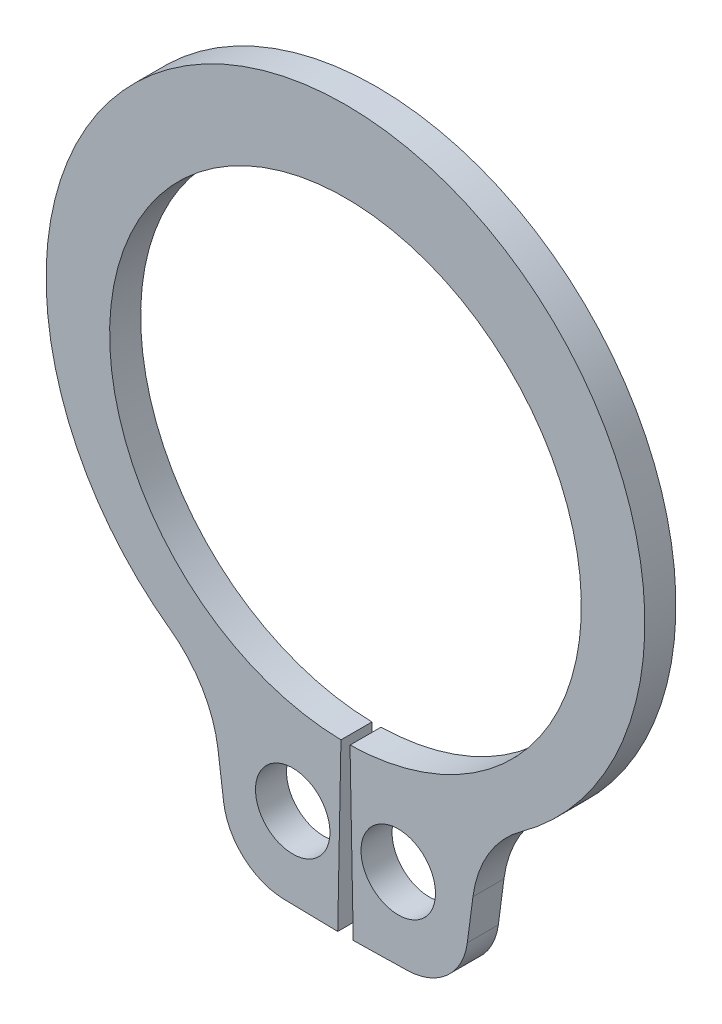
SolidWorks part; units mm, degrees
ref_plane "Plane1" through (0, 0, 0) normal (0, 0, 1) x (1, 0, 0)
ref_plane "Plane2" through (0, 0, 0) normal (0, 1, 0) x (1, 0, 0)
ref_plane "Plane3" through (0, 0, 0) normal (1, 0, 0) x (0, 0, -1)
other "Configuration Table"
sketch "Clipboard" plane through (0, 0, 0) normal (0, 0, 1) x (1, 0, 0)
  line L0 (0, 0) -> (0.65, 0)
  line L1 (0, 0) -> (0, 0.4)
  line L2 (0, 0) -> (0, -1.35)
  circle A0 centre (0, 0) radius 0.3
  circle A1 centre (0, 0) radius 2
sketch "BodySke" plane through (0, 0, 0) normal (0, 0, 1) x (1, 0, 0)
  line L0 (-1.5431, 0) -> (1.5431, 0) construction
  line L1 (0, 0) -> (0, 2.55) construction
  line L2 (0.0365, -1.8996) -> (0.0625, -3.2494)
  line L3 (-0.0365, -1.8996) -> (-0.0625, -3.2494)
  line L4 (0, 0) -> (1.9681, -2.5863) construction
  line L5 (0, 0) -> (-1.9681, -2.5863) construction
  line L6 (0.0625, -3.2494) -> (0.4952, -3.2411)
  line L7 (1.0266, -2.4624) -> (0.9813, -2.8064)
  line L8 (-1.0266, -2.4624) -> (-0.9813, -2.8064)
  line L9 (-0.0625, -3.2494) -> (-0.4952, -3.2411)
  circle A0 centre (0, 0) radius 1.9 construction
  arc A1 (0.0365, -1.8996) -> (-0.0365, -1.8996) centre (0, 0) ccw
  arc A2 (1.3928, -1.8303) -> (-1.3928, -1.8303) centre (0, 0.1384) ccw construction
  arc A3 (0.0625, -3.2494) -> (0.8139, -3.1464) centre (0, 0) ccw construction
  arc A4 (1.4121, -1.8165) -> (1.0266, -2.4624) centre (1.9681, -2.5863) ccw
  arc A5 (-1.0266, -2.4624) -> (-1.4121, -1.8165) centre (-1.9681, -2.5863) ccw
  arc A6 (-0.8139, -3.1464) -> (-0.0625, -3.2494) centre (0, 0) ccw construction
  arc A7 (1.4121, -1.8165) -> (-1.4121, -1.8165) centre (0, 0.1384) ccw
  arc A8 (-1.0331, -2.4131) -> (1.0331, -2.4131) centre (0, 0) ccw construction
  circle A9 centre (0.425, -2.5904) radius 0.3
  circle A10 centre (-0.425, -2.5904) radius 0.3
  arc A11 (0.9813, -2.8064) -> (0.4952, -3.2411) centre (0.4856, -2.7412) cw
  arc A12 (-0.9813, -2.8064) -> (-0.4952, -3.2411) centre (-0.4856, -2.7412) ccw
  point P28 (0.9413, -3.1107)
  point P31 (-0.9413, -3.1107)
extrude "Body" add sketch "BodySke" against normal blind 0.25
equation "' \"ShaftDia@Clipboard\" = 4"
equation "' \"Thickness@Body\" = 0.25"
equation "' \"GrooveDia@BodySke\" = 3.8"
equation "' \"LugSection@Clipboard\" = 1.35"
equation "' \"LargeSection@Clipboard\" = 0.65"
equation "' \"SmallSection@Clipboard\" = 0.4"
equation "' \"HoleDia@Clipboard\" = 0.6"
equation "' \"ShaftDia@Clipboard\" = 15"
equation "' \"Thickness@Body\" = 0.9"
equation "' \"GrooveDia@BodySke\" = 14.15"
equation "' \"LugSection@Clipboard\" = 2.8"
equation "' \"LargeSection@Clipboard\" = 1.8"
equation "' \"SmallSection@Clipboard\" = 1.05"
equation "' \"HoleDia@Clipboard\" = 1.2"
equation "\"Gap@BodySke\" =  \"Thickness@Body\" / 2"
equation "\"LargeRad@BodySke\" =  \"GrooveDia@BodySke\" / 2 +  \"LargeSection@Clipboard\""
equation "\"SmallRad@BodySke\" =  \"GrooveDia@BodySke\" / 2 +  \"SmallSection@Clipboard\""
equation "\"LugRad@BodySke\" = \"GrooveDia@BodySke\" / 2 + \"LugSection@Clipboard\""
equation "\"HoleOffsetRad@BodySke\" = (  \"ShaftDia@Clipboard\" / 2 + \"LugRad@BodySke\" ) / 2"
equation "\"HoleSpacing@BodySke\" = \"Gap@BodySke\"  * 2 +  \"HoleDia@Clipboard\""
equation "\"HoleDia@BodySke\" =  \"HoleDia@Clipboard\""
equation "\"SmallAngle@BodySke\" = atn(\"HoleSpacing@BodySke\" / 2 / sqr(\"HoleOffsetRad@BodySke\"  * \"HoleOffsetRad@BodySke\" - (\"HoleSpacing@BodySke\" / 2) * (\"HoleSpacing@BodySke\" / 2) ))  * 8 * ( 180 / 3.141593)"
